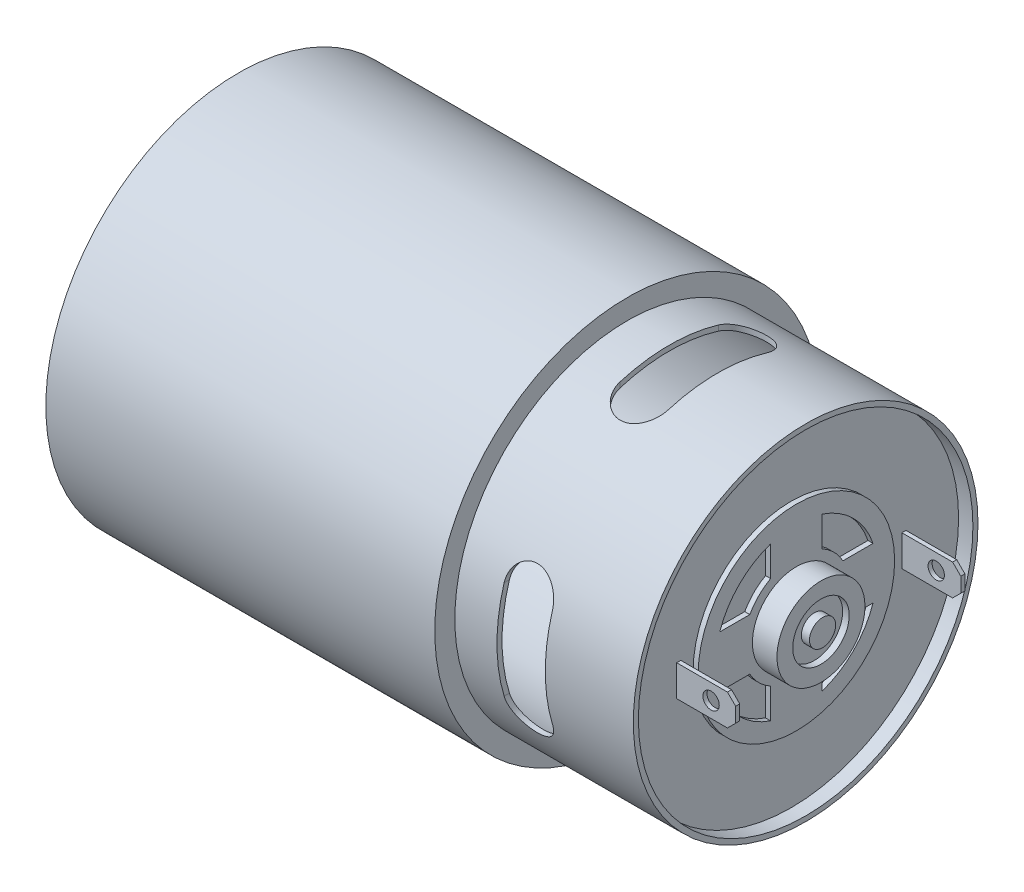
SolidWorks part; units mm, degrees
ref_plane "Front Plane" through (0, 0, 0) normal (0, 0, 1) x (1, 0, 0)
ref_plane "Top Plane" through (0, 0, 0) normal (0, 1, 0) x (1, 0, 0)
ref_plane "Right Plane" through (0, 0, 0) normal (1, 0, 0) x (0, 0, -1)
sketch "Sketch1" plane through (0, 0, 0) normal (0, 0, 1) x (1, 0, 0)
  line L0 (-77.87, 6.5) -> (-77.87, 2.5)
  line L1 (-77.87, 2.5) -> (-82.97, 2.5)
  line L2 (-4.44, 0) -> (0, 0)
  line L3 (-85.47, 0) -> (-72.75, 0)
  line L9 (0, 0) -> (-92.3389, 0) construction
  line L12 (-72.75, 0) -> (-72.75, 19.05)
  line L13 (-71.37, 20.43) -> (-4.44, 20.43)
  line L15 (-2.07, 21.05) -> (-23.87, 21.05)
  line L16 (-23.87, 21.05) -> (-23.87, 23.5)
  line L17 (-23.87, 23.5) -> (-71.37, 23.5)
  line L18 (-71.37, 23.5) -> (-71.37, 21.05)
  line L19 (-73.37, 19.05) -> (-73.37, 6.5)
  line L20 (-73.37, 6.5) -> (-77.87, 6.5)
  line L21 (-1, 3.45) -> (-0.2, 3.45)
  line L22 (-0.2, 3.45) -> (-0.2, 5.375)
  line L23 (-0.2, 5.375) -> (-3.2, 5.375)
  line L24 (-3.2, 5.375) -> (-3.2, 12)
  line L25 (-3.2, 12) -> (-3.82, 12)
  line L26 (-3.82, 12) -> (-3.82, 20.43)
  line L27 (-3.82, 20.43) -> (-2.07, 20.43)
  line L28 (-2.07, 20.43) -> (-2.07, 21.05)
  line L32 (-4.44, 20.43) -> (-4.44, 0)
  line L46 (0, 0) -> (0, 1.6)
  line L47 (0, 1.6) -> (-1, 1.6)
  line L48 (-1, 1.6) -> (-1, 3.45)
  arc A0 (-82.97, 2.5) -> (-85.47, 0) centre (-82.97, 0) ccw
  arc A5 (-71.37, 20.43) -> (-72.75, 19.05) centre (-71.37, 19.05) ccw
  arc A6 (-71.37, 21.05) -> (-73.37, 19.05) centre (-71.37, 19.05) ccw
  dimension "D1" = 2.5
  dimension "D2" = 1.38
  dimension "D3" = 2
  dimension "D4" = 13
  dimension "D5" = 0.2
  dimension "D6" = 1
  dimension "D7" = 2.07
  dimension "D8" = 3.2
  dimension "D9" = 72.75
  dimension "D10" = 4.44
  dimension "D11" = 23.87
  dimension "D12" = 1.6
  dimension "D13" = 3.45
  dimension "D14" = 77.87
  dimension "D15" = 85.47
  dimension "D16" = 5.375
  dimension "D17" = 12
  dimension "D18" = 20.43
  dimension "D20" = 23.5
revolve "Revolve1" add sketch "Sketch1" angle 360 mid plane about L9
sketch "Sketch2" plane through (0, 0, 0) normal (0, 0, 1) x (1, 0, 0)
  line L0 (-18.72, 6) -> (-18.72, -6)
  line L1 (-12.82, -6) -> (-12.82, 6)
  line L2 (0, 0) -> (-49.2336, 0) construction
  line L3 (-2.07, -21.05) -> (-2.07, 21.05) construction
  arc A0 (-12.82, 6) -> (-18.72, 6) centre (-15.77, 6) ccw
  arc A1 (-18.72, -6) -> (-12.82, -6) centre (-15.77, -6) ccw
  dimension "D1" = 5.9
  dimension "D2" = 12
  dimension "D3" = 10.75
extrude "Extrude1" cut sketch "Sketch2" against normal through all and the other way through all
pattern_circular "CirPattern1" count 4 over 360 about axis through (0, 0, 0) along (1, 0, 0) of "Extrude1"
sketch "Sketch3" plane through (-73.37, 0, 0) normal (-1, 0, 0) x (0, 0, 1)
  line L0 (15.4548, 4.1411) -> (11.5911, 3.1058)
  line L1 (3.1058, 11.5911) -> (4.1411, 15.4548)
  line L2 (0, 0) -> (11.3137, 11.3137) construction
  line L3 (0, 0) -> (12.9303, 0) construction
  arc A0 (15.4548, 4.1411) -> (4.1411, 15.4548) centre (0, 0) ccw
  arc A1 (11.5911, 3.1058) -> (3.1058, 11.5911) centre (0, 0) ccw
  dimension "D1" = 16
  dimension "D2" = 12
  dimension "D3" = 60
  dimension "D4" = 4
  dimension "D5" = 45
extrude "Extrude2" cut sketch "Sketch3" against normal up to next
pattern_circular "CirPattern2" count 4 over 360 about axis through (0, 0, 0) along (1, 0, 0) of "Extrude2"
sketch "Sketch4" plane through (-73.37, 0, 0) normal (-1, 0, 0) x (0, 0, 1)
  line L0 (0, 0) -> (17.1315, 0) construction
  line L1 (0, 0) -> (0, 9.404) construction
  circle A0 centre (12.5, 0) radius 1.25
  circle A1 centre (-12.5, 0) radius 1.25
  dimension "D1" = 2.5
  dimension "D2" = 12.5
extrude "Extrude3" cut sketch "Sketch4" against normal up to next
sketch "Sketch5" plane through (-3.2, 0, 0) normal (1, 0, 0) x (0, 0, -1)
  line L0 (9.3591, 3.15) -> (5.6857, 3.15)
  line L1 (3.15, 5.6857) -> (3.15, 9.3591)
  arc A0 (9.3591, 3.15) -> (3.15, 9.3591) centre (0, 0) ccw
  arc A1 (5.6857, 3.15) -> (3.15, 5.6857) centre (0, 0) ccw
  dimension "D1" = 9.875
  dimension "D2" = 6.5
  dimension "D3" = 6.2091
  dimension "D4" = 3.6734
extrude "Extrude4" cut sketch "Sketch5" against normal up to surface (0.62 mm away)
pattern_circular "CirPattern3" count 4 over 360 about axis through (0, 0, 0) along (1, 0, 0) of "Extrude4"
ref_plane "Plane1" through (0, 0, 14) normal (0, 0, 1) x (1, 0, 0)
sketch "Sketch6" plane through (0, 0, 14) normal (0, 0, 1) x (1, 0, 0)
  line L0 (0, 0) -> (7.2152, 0) construction
  line L1 (-3.82, -1.9) -> (3.38, -1.9)
  line L2 (-3.82, -1.9) -> (-3.82, 1.9)
  line L3 (-3.82, 1.9) -> (3.38, 1.9)
  line L4 (3.38, -1.9) -> (3.38, 1.9)
  line L5 (-3.82, -12) -> (-3.82, 12) construction
  dimension "D1" = 7.2
  dimension "D2" = 3.8
extrude "Extrude7" add sketch "Sketch6" against normal blind 0.5
sketch "Sketch7" plane through (0, 0, 14) normal (0, 0, 1) x (1, 0, 0)
  line L0 (3.38, -1.9) -> (3.38, 1.9) construction
  line L1 (3.38, 0) -> (-1.2681, 0) construction
  circle A0 centre (0.38, 0) radius 1
  dimension "D1" = 2
  dimension "D2" = 3
extrude "Extrude9" cut sketch "Sketch7" against normal up to next
chamfer "Chamfer1" distance 1 angle 45 2 edges at (3.38, -1.9, 13.75) (3.38, 1.9, 13.75)
mirror "Mirror1" about plane through (0, 0, 0) normal (0, 0, 1) of "Chamfer1", "Extrude9", "Extrude7"
fillet "Fillet1" radius 0.5 2 edges at (-77.87, 0, -6.5) (-73.37, 0, -6.5)
